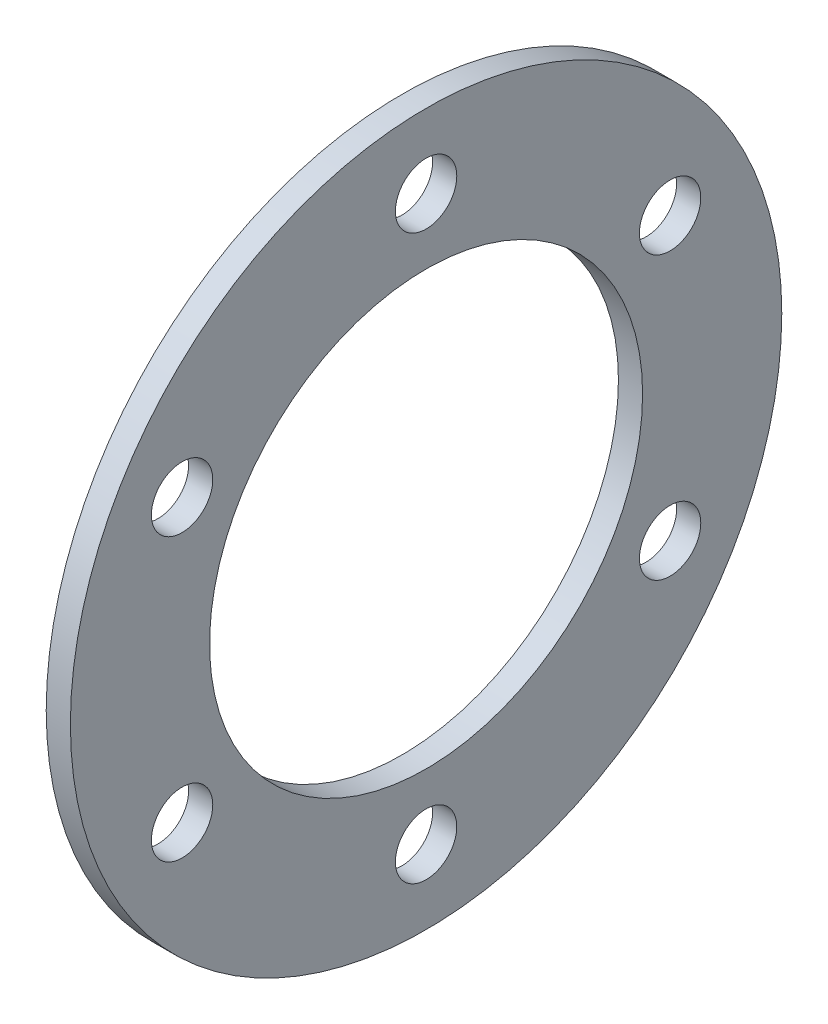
SolidWorks part; units mm, degrees
ref_plane "Front Plane" through (0, 0, 0) normal (0, 0, 1) x (1, 0, 0)
ref_plane "Top Plane" through (0, 0, 0) normal (0, 1, 0) x (1, 0, 0)
ref_plane "Right Plane" through (0, 0, 0) normal (1, 0, 0) x (0, 0, -1)
sketch "Sketch1" plane through (0, 0, 0) normal (1, 0, 0) x (0, 0, -1)
  circle A0 centre (0, 0) radius 28
  circle A1 centre (0, 0) radius 46
  dimension "D1" = 18
  dimension "D2" = 56
extrude "Boss-Extrude1" add sketch "Sketch1" along normal blind 3.125
sketch "Sketch2" plane through (3.125, 0, 0) normal (1, 0, 0) x (0, 0, -1)
  circle A0 centre (0, 0) radius 36.4353 construction
  circle A1 centre (0, 36.4353) radius 3.9687
  dimension "D1" = 72.8706
  dimension "D2" = 7.9375
extrude "Cut-Extrude1" cut sketch "Sketch2" against normal through all
pattern_circular "CirPattern1" count 6 over 360 about axis through (0, 0, 0) along (1, 0, 0) of "Cut-Extrude1"
